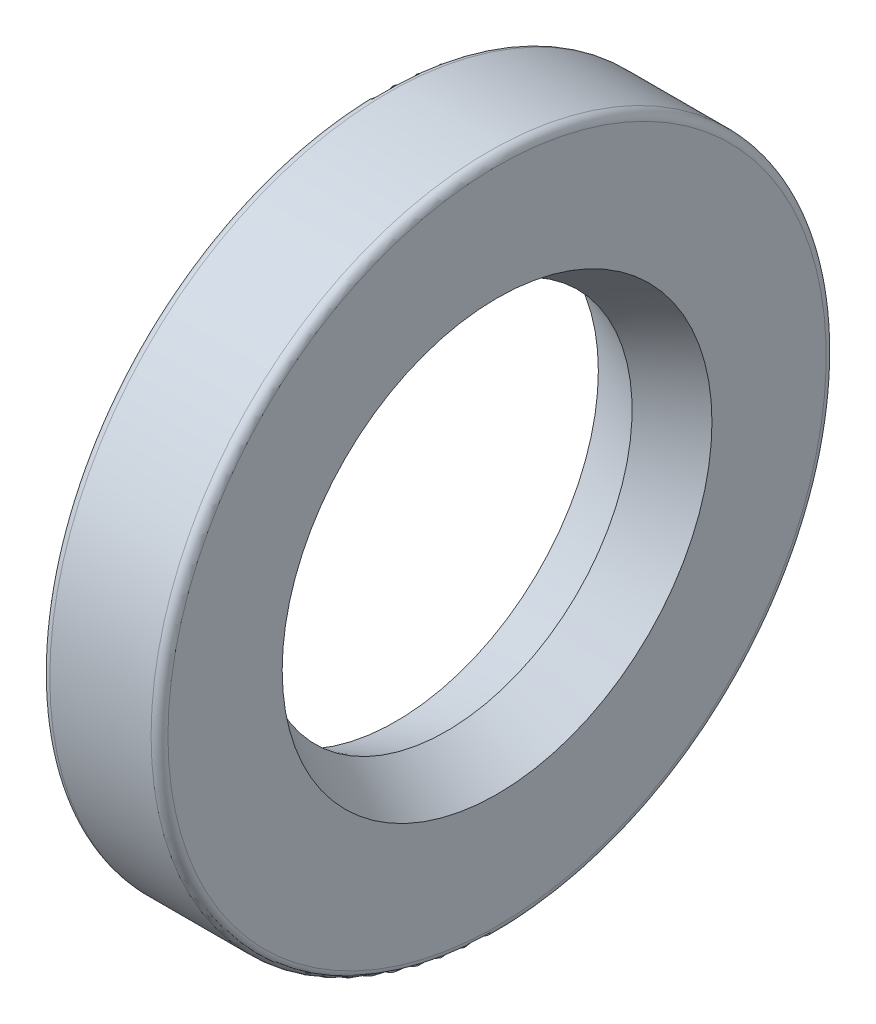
SolidWorks part; units mm, degrees
ref_plane "Plan de face" through (0, 0, 0) normal (0, 0, 1) x (1, 0, 0)
ref_plane "Plan de dessus" through (0, 0, 0) normal (0, 1, 0) x (1, 0, 0)
ref_plane "Plan de droite" through (0, 0, 0) normal (1, 0, 0) x (0, 0, -1)
sketch "Esquisse1" plane through (0, 0, 0) normal (0, 0, 1) x (1, 0, 0)
  line L0 (0, 18) -> (0, 20)
  line L1 (0, 20) -> (7, 20)
  line L2 (7, 20) -> (7, 12.7321)
  line L3 (7, 12.7321) -> (4, 11)
  line L4 (4, 11) -> (1, 12)
  line L5 (1, 14) -> (2, 14)
  line L6 (5, 14) -> (5, 18)
  line L7 (5, 18) -> (0, 18)
  line L8 (-16.7157, 0) -> (42.9028, 0) construction
  line L9 (4, 14) -> (5, 14)
  line L10 (1, 14) -> (1, 12)
  arc A0 (4, 14) -> (2, 14) centre (3, 14) ccw
  dimension "D11" = 1
  dimension "D1" = 40
  dimension "D2" = 22
  dimension "D3" = 7
  dimension "D4" = 2
  dimension "D5" = 5
  dimension "D6" = 1
  dimension "D7" = 2
  dimension "D8" = 1
  dimension "D9" = 3
  dimension "D10" = 30
revolve "Révolution1" add sketch "Esquisse1" angle 360 about L8
fillet "Congé1" radius 0.5 2 edges at (0, 0, 20) (7, 0, 20)
